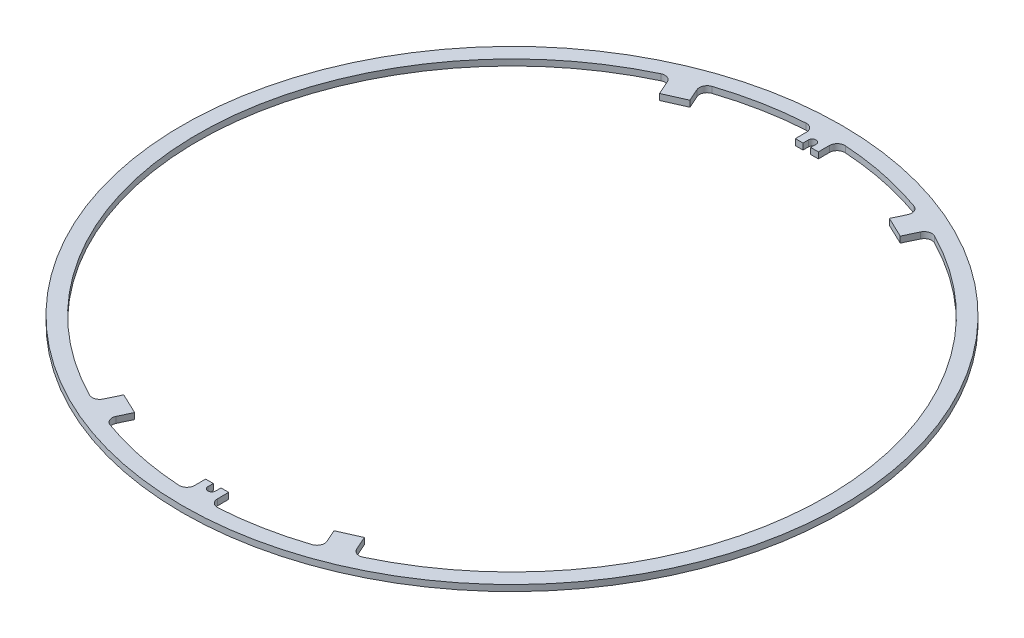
SolidWorks part; units mm, degrees
ref_plane "前视基准面" through (0, 0, 0) normal (0, 0, 1) x (1, 0, 0)
ref_plane "上视基准面" through (0, 0, 0) normal (0, 1, 0) x (1, 0, 0)
ref_plane "右视基准面" through (0, 0, 0) normal (1, 0, 0) x (0, 0, -1)
sketch "草图1" plane through (0, 0, 0) normal (0, 1, 0) x (1, 0, 0)
  circle A0 centre (0, 0) radius 43
  circle A1 centre (0, 0) radius 41
  circle A2 centre (0, 0) radius 35 construction
  dimension "D1" = 86
  dimension "D2" = 2
  dimension "D3" = 70
extrude "凸台-拉伸1" add sketch "草图1" along normal blind 0.8
sketch "草图2" plane through (0, 0.8, 0) normal (0, 1, 0) x (1, 0, 0)
  line L0 (0, 0) -> (0, 47.3857) construction
  line L1 (-1.5, 40.9726) -> (-1.5, 38.4726)
  line L2 (-1.5, 38.4726) -> (1.5, 38.4726)
  line L3 (1.5, 40.9726) -> (1.5, 38.4726)
  line L4 (0, 0) -> (51.4644, 0) construction
  line L5 (1.5, -40.9726) -> (1.5, -38.4726)
  line L6 (-1.5, -40.9726) -> (-1.5, -38.4726)
  line L7 (-1.5, -38.4726) -> (1.5, -38.4726)
  circle A0 centre (0, 0) radius 41 construction
  circle A1 centre (0, 0) radius 41
  point P10 (0, 38.4726)
  dimension "D1" = 2.5
  dimension "D2" = 3
extrude "凸台-拉伸2" add sketch "草图2" against normal up to surface (0.8 mm away) contours L7 L6 L5 M8 | L3 L1 L2 M8
fillet "圆角1" radius 1 2 edges at (1.5, 0.4, -40.9726) (-1.5, 0.4, -40.9726)
fillet "圆角2" radius 1 2 edges at (1.5, 0.4, 40.9726) (-1.5, 0.4, 40.9726)
sketch "草图3" plane through (0, 0, 0) normal (0, -1, 0) x (1, 0, 0)
  line L0 (0, 39.1726) -> (0, 38.4726) construction
  line L1 (1.5, 38.4726) -> (-1.5, 38.4726) construction
  line L2 (-0.5, 39.1726) -> (-0.5, 36.1726)
  line L3 (-0.5, 36.1726) -> (0.5, 36.1726)
  line L4 (0.5, 36.1726) -> (0.5, 39.1726)
  line L5 (0, 0) -> (11.294, 0) construction
  line L6 (0, -39.1726) -> (0, -38.4726) construction
  line L7 (0.5, -36.1726) -> (0.5, -39.1726)
  line L8 (-0.5, -36.1726) -> (0.5, -36.1726)
  line L9 (-0.5, -39.1726) -> (-0.5, -36.1726)
  arc A0 (0.5, 39.1726) -> (-0.5, 39.1726) centre (0, 39.1726) ccw
  arc A1 (0.5, -39.1726) -> (-0.5, -39.1726) centre (0, -39.1726) cw
  dimension "D1" = 1
  dimension "D2" = 3
  dimension "D3" = 0.7
extrude "切除-拉伸1" cut sketch "草图3" against normal through all
sketch "草图4" plane through (0, 0.8, 0) normal (0, 1, 0) x (1, 0, 0)
  line L0 (0, 0) -> (-17.651, -37.006) construction
  line L1 (0, 0) -> (0, -48.4381) construction
  line L2 (-17.651, -37.006) -> (-16.3594, -34.2982)
  line L3 (-16.3594, -34.2982) -> (-13.6517, -35.5898)
  line L4 (-13.6517, -35.5898) -> (-14.8959, -38.1983)
  line L5 (17.651, 37.006) -> (16.3594, 34.2982)
  line L6 (16.3594, 34.2982) -> (13.6517, 35.5898)
  line L7 (13.6517, 35.5898) -> (14.8959, 38.1983)
  arc A0 (-2.5625, 40.9198) -> (-2.5625, -40.9198) centre (0, 0) ccw construction
  arc A1 (-17.651, -37.006) -> (-14.8959, -38.1983) centre (0, 0) ccw
  arc A2 (17.651, 37.006) -> (14.8959, 38.1983) centre (0, 0) ccw
  point P16 (0, 0)
  dimension "D1" = 3
  dimension "D2" = 3
  dimension "D4" = 25.5
  dimension "D3" = 2
extrude "凸台-拉伸3" add sketch "草图4" against normal up to surface (0.8 mm away)
fillet "圆角3" radius 1 4 edges at (17.651, 0.4, -37.006) (14.8959, 0.4, -38.1983) (-14.8959, 0.4, 38.1983) (-17.651, 0.4, 37.006)
sketch "草图5" plane through (0, 0, 0) normal (0, -1, 0) x (1, 0, 0)
  line L0 (0, 0) -> (-16.3594, 34.2982) construction
  line L1 (0, 0) -> (16.6762, 37.4554) construction
  line L2 (16.6762, 37.4554) -> (15.456, 34.7147)
  line L3 (15.456, 34.7147) -> (12.7154, 35.9349)
  line L4 (12.7154, 35.9349) -> (13.8909, 38.5752)
  line L5 (-12.7154, -35.9349) -> (-13.8909, -38.5752)
  line L6 (-15.456, -34.7147) -> (-12.7154, -35.9349)
  line L7 (-16.6762, -37.4554) -> (-15.456, -34.7147)
  arc A0 (18.5706, -36.5532) -> (2.5625, 40.9198) centre (0, 0) ccw construction
  arc A1 (16.6762, 37.4554) -> (13.8909, 38.5752) centre (0, 0) ccw
  arc A2 (-16.6762, -37.4554) -> (-13.8909, -38.5752) centre (0, 0) ccw
  point P17 (0, 0)
  dimension "D1" = 49.5
  dimension "D2" = 3
  dimension "D3" = 3
  dimension "D4" = 2
extrude "凸台-拉伸4" add sketch "草图5" against normal up to surface (0.8 mm away)
fillet "圆角4" radius 1 4 edges at (-13.8909, 0.4, -38.5752) (-16.6762, 0.4, -37.4554) (16.6762, 0.4, 37.4554) (13.8909, 0.4, 38.5752)
